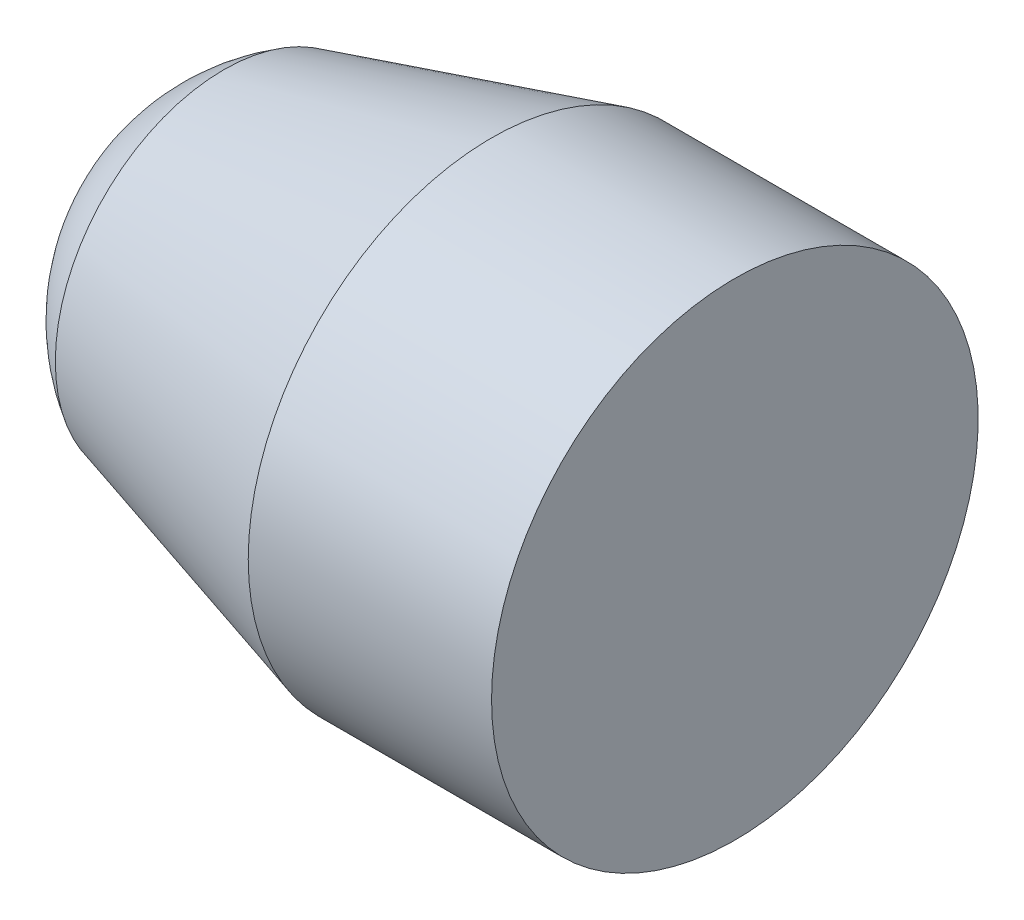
SolidWorks part; units mm, degrees
ref_plane "Front Plane" through (0, 0, 0) normal (0, 0, 1) x (1, 0, 0)
ref_plane "Top Plane" through (0, 0, 0) normal (0, 1, 0) x (1, 0, 0)
ref_plane "Right Plane" through (0, 0, 0) normal (1, 0, 0) x (0, 0, -1)
sketch "Sketch1" plane through (0, 0, 0) normal (0, 0, 1) x (1, 0, 0)
  line L0 (1.016, 1.7598) -> (3.81, 2.54)
  line L1 (3.81, 2.54) -> (6.35, 2.54)
  line L2 (6.35, 0) -> (0, 0)
  line L4 (6.35, 2.54) -> (6.35, 0)
  line L6 (-0.3422, 0) -> (6.0078, 0) construction
  arc A0 (1.016, 1.7598) -> (0, 0) centre (2.032, 0) ccw
  dimension "D1" = 2.032
  dimension "D4" = 60
  dimension "D2" = 6.35
  dimension "D3" = 2.54
  dimension "D5" = 2.54
revolve "Revolve6" add sketch "Sketch1" angle 360 about L6
